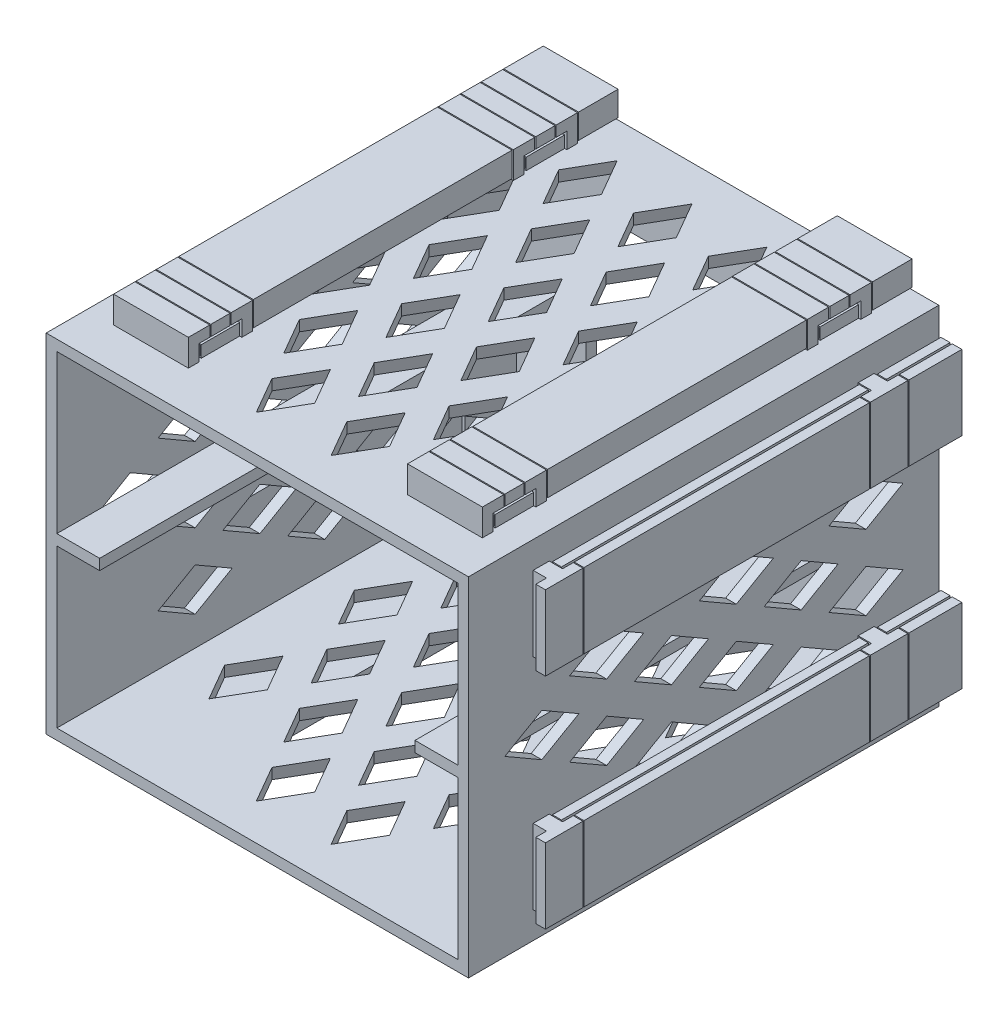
SolidWorks part; units mm, degrees
ref_plane "Alzado" through (0, 0, 0) normal (0, 0, 1) x (1, 0, 0)
ref_plane "Planta" through (0, 0, 0) normal (0, 1, 0) x (1, 0, 0)
ref_plane "Vista lateral" through (0, 0, 0) normal (1, 0, 0) x (0, 0, -1)
sketch "Croquis1" plane through (0, 0, 0) normal (0, 0, -1) x (-1, 0, 0)
  line L1 (-39.5, 32.5) -> (39.5, 32.5)
  line L2 (-39.5, 32.5) -> (-39.5, -32.5)
  line L3 (-39.5, -32.5) -> (39.5, -32.5)
  line L4 (39.5, 32.5) -> (39.5, -32.5)
  line L7 (-24.5, 17.5) -> (24.5, 17.5)
  line L8 (-24.5, 17.5) -> (-24.5, -17.5)
  line L9 (-24.5, -17.5) -> (24.5, -17.5)
  line L10 (24.5, 17.5) -> (24.5, -17.5)
extrude "Fondo" add sketch "Croquis1" against normal blind 2 separate body
sketch "Croquis3" plane through (0, 0, 2) normal (0, 0, 1) x (1, 0, 0)
  line L1 (-39.5, 32.5) -> (39.5, 32.5)
  line L2 (-39.5, 32.5) -> (-39.5, -32.5)
  line L3 (-39.5, -32.5) -> (39.5, -32.5)
  line L4 (39.5, 32.5) -> (39.5, -32.5)
  line L6 (-37.5, 30.5) -> (-37.5, -30.5)
  line L7 (-37.5, 30.5) -> (37.5, 30.5)
  line L8 (37.5, 30.5) -> (37.5, -30.5)
  line L9 (-37.5, -30.5) -> (37.5, -30.5)
extrude "Estructura" add sketch "Croquis3" along normal blind 86
sketch "Croquis5" plane through (-39.5, 0, 0) normal (-1, 0, 0) x (0, 0, 1)
  line L0 (13.628, 25) -> (20.556, 21)
  line L1 (20.556, 21) -> (13.628, 17)
  line L2 (13.628, 17) -> (6.7, 21)
  line L3 (6.7, 21) -> (13.628, 25)
  line L4 (0, -32.5) -> (0, 32.5) construction
  line L5 (88, 32.5) -> (0, 32.5) construction
  line L6 (13.628, 11) -> (20.556, 7)
  line L7 (6.7, 7) -> (13.628, 11)
  line L8 (13.628, 3) -> (6.7, 7)
  line L9 (20.556, 7) -> (13.628, 3)
  line L10 (13.628, -3) -> (20.556, -7)
  line L11 (6.7, -7) -> (13.628, -3)
  line L12 (13.628, -11) -> (6.7, -7)
  line L13 (20.556, -7) -> (13.628, -11)
  line L14 (13.628, -17) -> (20.556, -21)
  line L15 (6.7, -21) -> (13.628, -17)
  line L16 (13.628, -25) -> (6.7, -21)
  line L17 (20.556, -21) -> (13.628, -25)
  line L18 (37.884, 25) -> (44.812, 21)
  line L19 (44.812, 21) -> (37.884, 17)
  line L20 (37.884, 17) -> (30.956, 21)
  line L21 (30.956, 21) -> (37.884, 25)
  line L22 (44.812, 7) -> (37.884, 3)
  line L23 (37.884, 11) -> (44.812, 7)
  line L24 (30.956, 7) -> (37.884, 11)
  line L25 (37.884, 3) -> (30.956, 7)
  line L26 (44.812, -7) -> (37.884, -11)
  line L27 (37.884, -3) -> (44.812, -7)
  line L28 (30.956, -7) -> (37.884, -3)
  line L29 (37.884, -11) -> (30.956, -7)
  line L30 (37.884, -17) -> (44.812, -21)
  line L31 (44.812, -21) -> (37.884, -25)
  line L32 (37.884, -25) -> (30.956, -21)
  line L33 (30.956, -21) -> (37.884, -17)
  line L34 (62.14, 25) -> (69.068, 21)
  line L35 (69.068, 21) -> (62.14, 17)
  line L36 (62.14, 17) -> (55.212, 21)
  line L37 (55.212, 21) -> (62.14, 25)
  line L38 (69.068, 7) -> (62.14, 3)
  line L39 (62.14, 11) -> (69.068, 7)
  line L40 (55.212, 7) -> (62.14, 11)
  line L41 (62.14, 3) -> (55.212, 7)
  line L42 (69.068, -7) -> (62.14, -11)
  line L43 (62.14, -3) -> (69.068, -7)
  line L44 (55.212, -7) -> (62.14, -3)
  line L45 (62.14, -11) -> (55.212, -7)
  line L46 (62.14, -17) -> (69.068, -21)
  line L47 (69.068, -21) -> (62.14, -25)
  line L48 (62.14, -25) -> (55.212, -21)
  line L49 (55.212, -21) -> (62.14, -17)
  line L66 (50.012, 18) -> (56.94, 14)
  line L67 (56.94, 14) -> (50.012, 10)
  line L68 (50.012, 10) -> (43.084, 14)
  line L69 (43.084, 14) -> (50.012, 18)
  line L70 (50.012, 4) -> (56.94, 0)
  line L71 (43.084, 0) -> (50.012, 4)
  line L72 (50.012, -4) -> (43.084, 0)
  line L73 (56.94, -14) -> (50.012, -18)
  line L74 (50.012, -10) -> (56.94, -14)
  line L75 (43.084, -14) -> (50.012, -10)
  line L76 (18.828, 14) -> (25.756, 18)
  line L77 (67.34, 14) -> (74.268, 18) construction
  line L78 (67.34, -14) -> (74.268, -10) construction
  line L79 (74.268, -18) -> (67.34, -14) construction
  line L80 (25.756, 4) -> (32.684, 0)
  line L81 (18.828, 0) -> (25.756, 4)
  line L82 (25.756, -4) -> (18.828, 0)
  line L83 (32.684, 0) -> (25.756, -4)
  line L84 (25.756, -18) -> (18.828, -14)
  line L85 (32.684, -14) -> (25.756, -18)
  line L86 (56.94, 0) -> (50.012, -4)
  line L87 (50.012, -18) -> (43.084, -14)
  line L88 (32.684, 14) -> (25.756, 10)
  line L89 (25.756, 10) -> (18.828, 14)
  line L90 (25.756, 18) -> (32.684, 14)
  line L91 (74.268, 18) -> (81.196, 14) construction
  line L92 (81.196, 14) -> (74.268, 10) construction
  line L93 (74.268, 10) -> (67.34, 14) construction
  line L94 (81.196, 0) -> (74.268, -4)
  line L95 (74.268, 4) -> (81.196, 0)
  line L96 (67.34, 0) -> (74.268, 4)
  line L97 (74.268, -4) -> (67.34, 0)
  line L98 (81.196, -14) -> (74.268, -18) construction
  line L99 (74.268, -10) -> (81.196, -14) construction
  line L100 (25.756, -10) -> (32.684, -14)
  line L101 (18.828, -14) -> (25.756, -10)
  line L102 (88, 32.5) -> (0, 32.5) construction
  line L103 (86.396, 25) -> (93.324, 21)
  line L104 (93.324, 21) -> (86.396, 17)
  line L105 (86.396, 17) -> (79.468, 21)
  line L106 (79.468, 21) -> (86.396, 25)
  line L107 (93.324, 7) -> (86.396, 3)
  line L108 (86.396, 11) -> (93.324, 7)
  line L109 (79.468, 7) -> (86.396, 11)
  line L110 (86.396, 3) -> (79.468, 7)
  line L111 (93.324, -7) -> (86.396, -11)
  line L112 (86.396, -3) -> (93.324, -7)
  line L113 (79.468, -7) -> (86.396, -3)
  line L114 (86.396, -11) -> (79.468, -7)
  line L115 (86.396, -17) -> (93.324, -21)
  line L116 (93.324, -21) -> (86.396, -25)
  line L117 (86.396, -25) -> (79.468, -21)
  line L118 (79.468, -21) -> (86.396, -17)
  dimension "D1" = 7.9998
  dimension "D2" = 7.9998
  dimension "D3" = 6.7
  dimension "D4" = 7.5
  dimension "D5" = 8
  dimension "D7" = 13.856
  dimension "D9" = 24.256
  dimension "D10" = 14.5
  dimension "D11" = 24.256
  dimension "D6" = 4
  dimension "D8" = 4
extrude "RombosHor" cut sketch "Croquis5" against normal up to surface (79 mm away)
sketch "Croquis9" plane through (0, 32.5, 0) normal (0, 1, 0) x (1, 0, 0)
  line L0 (28, -6.6872) -> (24, -13.6154)
  line L1 (28, -6.6872) -> (32, -13.6154)
  line L2 (24, -13.6154) -> (28, -20.5436)
  line L3 (32, -13.6154) -> (28, -20.5436)
  line L4 (14, -6.6872) -> (10, -13.6154)
  line L5 (14, -6.6872) -> (18, -13.6154)
  line L6 (18, -13.6154) -> (14, -20.5436)
  line L7 (10, -13.6154) -> (14, -20.5436)
  line L8 (0, -6.6872) -> (-4, -13.6154)
  line L9 (0, -6.6872) -> (4, -13.6154)
  line L10 (4, -13.6154) -> (0, -20.5436)
  line L11 (-4, -13.6154) -> (0, -20.5436)
  line L12 (-14, -6.6872) -> (-18, -13.6154)
  line L13 (-14, -6.6872) -> (-10, -13.6154)
  line L14 (-10, -13.6154) -> (-14, -20.5436)
  line L15 (-18, -13.6154) -> (-14, -20.5436)
  line L16 (-28, -6.6872) -> (-32, -13.6154)
  line L17 (-28, -6.6872) -> (-24, -13.6154)
  line L18 (-24, -13.6154) -> (-28, -20.5436)
  line L19 (-32, -13.6154) -> (-28, -20.5436)
  line L20 (14, -30.9436) -> (10, -37.8718)
  line L21 (14, -30.9436) -> (18, -37.8718)
  line L22 (18, -37.8718) -> (14, -44.8)
  line L23 (10, -37.8718) -> (14, -44.8)
  line L24 (0, -30.9436) -> (-4, -37.8718)
  line L25 (0, -30.9436) -> (4, -37.8718)
  line L26 (4, -37.8718) -> (0, -44.8)
  line L27 (-4, -37.8718) -> (0, -44.8)
  line L28 (-14, -30.9436) -> (-18, -37.8718)
  line L29 (-14, -30.9436) -> (-10, -37.8718)
  line L30 (-10, -37.8718) -> (-14, -44.8)
  line L31 (-18, -37.8718) -> (-14, -44.8)
  line L32 (-28, -30.9436) -> (-32, -37.8718)
  line L33 (-28, -30.9436) -> (-24, -37.8718)
  line L34 (-24, -37.8718) -> (-28, -44.8)
  line L35 (-32, -37.8718) -> (-28, -44.8)
  line L36 (14, -55.2) -> (10, -62.1282)
  line L37 (14, -55.2) -> (18, -62.1282)
  line L38 (18, -62.1282) -> (14, -69.0564)
  line L39 (10, -62.1282) -> (14, -69.0564)
  line L40 (0, -55.2) -> (-4, -62.1282)
  line L41 (0, -55.2) -> (4, -62.1282)
  line L42 (4, -62.1282) -> (0, -69.0564)
  line L43 (-4, -62.1282) -> (0, -69.0564)
  line L44 (-14, -55.2) -> (-18, -62.1282)
  line L45 (-14, -55.2) -> (-10, -62.1282)
  line L46 (-10, -62.1282) -> (-14, -69.0564)
  line L47 (-18, -62.1282) -> (-14, -69.0564)
  line L48 (-28, -55.2) -> (-32, -62.1282)
  line L49 (-28, -55.2) -> (-24, -62.1282)
  line L50 (-24, -62.1282) -> (-28, -69.0564)
  line L51 (-32, -62.1282) -> (-28, -69.0564)
  line L68 (28, -30.9436) -> (24, -37.8718)
  line L69 (28, -30.9436) -> (32, -37.8718)
  line L70 (32, -37.8718) -> (28, -44.8)
  line L71 (24, -37.8718) -> (28, -44.8)
  line L72 (28, -55.2) -> (24, -62.1282)
  line L73 (28, -55.2) -> (32, -62.1282)
  line L74 (32, -62.1282) -> (28, -69.0564)
  line L75 (24, -62.1282) -> (28, -69.0564)
  line L80 (28, -6.6872) -> (14, -6.6872) construction
  line L81 (28, -6.6872) -> (28, -30.9436) construction
  line L83 (39.5, -88) -> (39.5, 0) construction
  line L87 (-39.5, 0) -> (39.5, 0) construction
  line L88 (17, -50.0018) -> (21, -56.93)
  line L89 (7, -67.33) -> (11, -74.2582)
  line L90 (-7, -67.33) -> (-11, -74.2582)
  line L91 (-7, -67.33) -> (-3, -74.2582)
  line L92 (-3, -74.2582) -> (-7, -81.1864)
  line L93 (-21, -67.33) -> (-25, -74.2582) construction
  line L94 (-21, -67.33) -> (-17, -74.2582) construction
  line L95 (-25, -74.2582) -> (-21, -81.1864) construction
  line L96 (21, -67.33) -> (25, -74.2582) construction
  line L97 (25, -74.2582) -> (21, -81.1864) construction
  line L98 (17, -74.2582) -> (21, -81.1864) construction
  line L99 (7, -18.8172) -> (3, -25.7454)
  line L100 (17, -25.7454) -> (21, -32.6736)
  line L101 (21, -18.8172) -> (25, -25.7454)
  line L102 (-7, -43.0736) -> (-11, -50.0018)
  line L103 (-3, -50.0018) -> (-7, -56.93)
  line L104 (-21, -43.0736) -> (-25, -50.0018)
  line L105 (-21, -43.0736) -> (-17, -50.0018)
  line L106 (-3, -25.7454) -> (-7, -32.6736)
  line L107 (-11, -25.7454) -> (-7, -32.6736)
  line L108 (-21, -18.8172) -> (-17, -25.7454)
  line L109 (-21, -18.8172) -> (-25, -25.7454)
  line L110 (-25, -25.7454) -> (-21, -32.6736)
  line L111 (21, -43.0736) -> (17, -50.0018)
  line L112 (11, -25.7454) -> (7, -32.6736)
  line L113 (7, -18.8172) -> (11, -25.7454)
  line L114 (7, -67.33) -> (3, -74.2582)
  line L115 (11, -74.2582) -> (7, -81.1864)
  line L116 (3, -74.2582) -> (7, -81.1864)
  line L117 (-11, -74.2582) -> (-7, -81.1864)
  line L118 (-17, -74.2582) -> (-21, -81.1864) construction
  line L119 (21, -67.33) -> (17, -74.2582) construction
  line L120 (7, -43.0736) -> (3, -50.0018)
  line L121 (7, -43.0736) -> (11, -50.0018)
  line L122 (11, -50.0018) -> (7, -56.93)
  line L123 (3, -50.0018) -> (7, -56.93)
  line L124 (21, -43.0736) -> (25, -50.0018)
  line L125 (25, -50.0018) -> (21, -56.93)
  line L126 (21, -18.8172) -> (17, -25.7454)
  line L127 (-7, -43.0736) -> (-3, -50.0018)
  line L128 (-11, -50.0018) -> (-7, -56.93)
  line L129 (-17, -50.0018) -> (-21, -56.93)
  line L130 (-25, -50.0018) -> (-21, -56.93)
  line L131 (-7, -18.8172) -> (-11, -25.7454)
  line L132 (-7, -18.8172) -> (-3, -25.7454)
  line L133 (-17, -25.7454) -> (-21, -32.6736)
  line L134 (3, -25.7454) -> (7, -32.6736)
  line L135 (25, -25.7454) -> (21, -32.6736)
  line L136 (18, -86.3846) -> (14, -93.3128)
  line L137 (10, -86.3846) -> (14, -93.3128)
  line L138 (4, -86.3846) -> (0, -93.3128)
  line L139 (-4, -86.3846) -> (0, -93.3128)
  line L140 (-10, -86.3846) -> (-14, -93.3128)
  line L141 (-18, -86.3846) -> (-14, -93.3128)
  line L142 (-24, -86.3846) -> (-28, -93.3128)
  line L143 (-32, -86.3846) -> (-28, -93.3128)
  line L144 (32, -86.3846) -> (28, -93.3128)
  line L145 (24, -86.3846) -> (28, -93.3128)
  line L146 (14, -79.4564) -> (10, -86.3846)
  line L147 (14, -79.4564) -> (18, -86.3846)
  line L148 (0, -79.4564) -> (-4, -86.3846)
  line L149 (0, -79.4564) -> (4, -86.3846)
  line L150 (-14, -79.4564) -> (-18, -86.3846)
  line L151 (-14, -79.4564) -> (-10, -86.3846)
  line L152 (-28, -79.4564) -> (-32, -86.3846)
  line L153 (-28, -79.4564) -> (-24, -86.3846)
  line L154 (28, -79.4564) -> (24, -86.3846)
  line L155 (28, -79.4564) -> (32, -86.3846)
  dimension "D1" = 8
  dimension "D2" = 8
  dimension "D3" = 8
  dimension "D4" = 13.8564
  dimension "D7" = 14
  dimension "D8" = 24.2564
  dimension "D9" = 6.6872
  dimension "D10" = 7.5
  dimension "D5" = 5
  dimension "D6" = 4
extrude "RombosVert" cut sketch "Croquis9" against normal up to surface (65 mm away)
sketch "Croquis8" plane through (0, 0, 2) normal (0, 0, 1) x (1, 0, 0)
  line L0 (-37.5, -30.5) -> (37.5, -30.5) construction
  line L1 (-29.5, -1) -> (-37.5, -1)
  line L2 (-29.5, -1) -> (-29.5, 1)
  line L3 (-29.5, 1) -> (-37.5, 1)
  line L4 (-37.5, -1) -> (-37.5, 1)
  line L5 (29.5, 1) -> (37.5, 1)
  line L6 (29.5, 1) -> (29.5, -1)
  line L7 (29.5, -1) -> (37.5, -1)
  line L8 (37.5, 1) -> (37.5, -1)
  dimension "D1" = 8
  dimension "D2" = 2
  dimension "D3" = 29.5
extrude "Guias" add sketch "Croquis8" along normal blind 86
sketch "Croquis10" plane through (39.5, 0, 0) normal (1, 0, 0) x (0, 0, -1)
  line L0 (-88, 32.5) -> (0, 32.5) construction
  line L1 (-12.104, -27.5) -> (-12.104, -13.5)
  line L2 (-15.104, -13.5) -> (-12.104, -13.5)
  line L3 (-15.104, -27.5) -> (-15.104, -13.5)
  line L4 (-15.104, -27.5) -> (-12.104, -27.5)
  line L5 (-88, 0) -> (0, 0) construction
  line L6 (-75.896, 27.5) -> (-75.896, 13.5)
  line L7 (-72.896, 13.5) -> (-75.896, 13.5)
  line L8 (-72.896, 27.5) -> (-72.896, 13.5)
  line L9 (0, 32.5) -> (0, -32.5) construction
  line L11 (-44, -32.5) -> (-44, 32.5) construction
  line L12 (-15.104, 27.5) -> (-12.104, 27.5)
  line L13 (-15.104, 27.5) -> (-15.104, 13.5)
  line L14 (-15.104, 13.5) -> (-12.104, 13.5)
  line L15 (-12.104, 27.5) -> (-12.104, 13.5)
  line L16 (-72.896, 27.5) -> (-75.896, 27.5)
  line L17 (-72.896, -27.5) -> (-75.896, -27.5)
  line L18 (-72.896, -27.5) -> (-72.896, -13.5)
  line L19 (-72.896, -13.5) -> (-75.896, -13.5)
  line L20 (-75.896, -27.5) -> (-75.896, -13.5)
  line L21 (-88, -32.5) -> (0, -32.5) construction
  dimension "D1" = 44
  dimension "D2" = 32.5
  dimension "D6" = 3
  dimension "D7" = 14
  dimension "D8" = 5
  dimension "D9" = 12.104
extrude "AncDer01" add sketch "Croquis10" along normal blind 2.5
sketch "Croquis11" plane through (42, 0, 0) normal (1, 0, 0) x (0, 0, -1)
  line L0 (-15.104, 13.5) -> (-12.104, 13.5) construction
  line L1 (0, 32.5) -> (0, -32.5) construction
  line L2 (-15.104, 27.5) -> (-15.104, 24.1478) construction
  line L3 (-17.104, 27.5) -> (-10.104, 27.5)
  line L4 (-17.104, 27.5) -> (-17.104, 13.5)
  line L5 (-44, 32.5) -> (-44, -32.5) construction
  line L6 (-12.104, 27.5) -> (-15.104, 27.5) construction
  line L7 (-10.104, -27.5) -> (-10.104, -13.5)
  line L8 (-17.104, 13.5) -> (-10.104, 13.5)
  line L9 (-17.104, -13.5) -> (-10.104, -13.5)
  line L10 (-88, 0) -> (0, 0) construction
  line L11 (-10.104, 27.5) -> (-10.104, 13.5)
  line L12 (-17.104, -27.5) -> (-17.104, -13.5)
  line L13 (-17.104, -27.5) -> (-10.104, -27.5)
  line L14 (-70.896, -27.5) -> (-77.896, -27.5)
  line L15 (-70.896, -27.5) -> (-70.896, -13.5)
  line L16 (-77.896, 27.5) -> (-77.896, 13.5)
  line L17 (-70.896, -13.5) -> (-77.896, -13.5)
  line L18 (-70.896, 13.5) -> (-77.896, 13.5)
  line L19 (-77.896, -27.5) -> (-77.896, -13.5)
  line L20 (-70.896, 27.5) -> (-70.896, 13.5)
  line L21 (-70.896, 27.5) -> (-77.896, 27.5)
  dimension "D1" = 44
  dimension "D2" = 88
  dimension "D3" = 7
  dimension "D4" = 2
extrude "AncDer02" add sketch "Croquis11" along normal blind 1.8
sketch "Croquis12" plane through (0, 32.5, 0) normal (0, 1, 0) x (1, 0, 0)
  line L1 (20.5, -9.604) -> (20.5, -7.604)
  line L2 (34.5, -7.604) -> (20.5, -7.604)
  line L3 (34.5, -9.604) -> (34.5, -7.604)
  line L4 (34.5, -9.604) -> (20.5, -9.604)
  line L5 (20.5, -19.604) -> (20.5, -17.604)
  line L6 (34.5, -17.604) -> (20.5, -17.604)
  line L7 (34.5, -19.604) -> (34.5, -17.604)
  line L8 (34.5, -19.604) -> (20.5, -19.604)
  line L10 (39.5, -44) -> (-39.5, -44) construction
  line L11 (-20.5, -78.396) -> (-20.5, -80.396)
  line L12 (-34.5, -80.396) -> (-20.5, -80.396)
  line L13 (0, -88) -> (0, 0) construction
  line L14 (-34.5, -78.396) -> (-34.5, -80.396)
  line L15 (-34.5, -78.396) -> (-20.5, -78.396)
  line L16 (-20.5, -68.396) -> (-20.5, -70.396)
  line L17 (-34.5, -70.396) -> (-20.5, -70.396)
  line L18 (-34.5, -68.396) -> (-34.5, -70.396)
  line L19 (-34.5, -68.396) -> (-20.5, -68.396)
  line L20 (34.5, -68.396) -> (20.5, -68.396)
  line L21 (-34.5, -19.604) -> (-20.5, -19.604)
  line L22 (-34.5, -19.604) -> (-34.5, -17.604)
  line L23 (-34.5, -17.604) -> (-20.5, -17.604)
  line L24 (-20.5, -19.604) -> (-20.5, -17.604)
  line L25 (-34.5, -9.604) -> (-20.5, -9.604)
  line L26 (-34.5, -9.604) -> (-34.5, -7.604)
  line L27 (-34.5, -7.604) -> (-20.5, -7.604)
  line L28 (-20.5, -9.604) -> (-20.5, -7.604)
  line L29 (34.5, -68.396) -> (34.5, -70.396)
  line L30 (34.5, -70.396) -> (20.5, -70.396)
  line L31 (20.5, -68.396) -> (20.5, -70.396)
  line L32 (34.5, -78.396) -> (20.5, -78.396)
  line L33 (34.5, -78.396) -> (34.5, -80.396)
  line L34 (34.5, -80.396) -> (20.5, -80.396)
  line L35 (20.5, -78.396) -> (20.5, -80.396)
  line L38 (-39.5, 0) -> (39.5, 0) construction
  line L39 (-39.5, -88) -> (-39.5, 0) construction
  dimension "D9" = 88
  dimension "D10" = 44
  dimension "D11" = 2
  dimension "D12" = 2
  dimension "D13" = 14
  dimension "D14" = 14
  dimension "D15" = 5
  dimension "D16" = 5
  dimension "D17" = 7.604
  dimension "D18" = 8
extrude "AncSup01" add sketch "Croquis12" along normal blind 3
sketch "Croquis13" plane through (0, 35.5, 0) normal (0, 1, 0) x (1, 0, 0)
  line L0 (39.5, -44) -> (-39.5, -44) construction
  line L2 (-39.5, 0) -> (39.5, 0) construction
  line L3 (-20.5, -9.604) -> (-20.5, -7.604) construction
  line L4 (-34.5, -7.604) -> (-20.5, -7.604)
  line L5 (-34.5, -7.604) -> (-34.5, -11.604)
  line L6 (-34.5, -11.604) -> (-20.5, -11.604)
  line L7 (-20.5, -7.604) -> (-20.5, -11.604)
  line L8 (-27.4575, -19.604) -> (-21.4543, -19.604) construction
  line L10 (-34.5, -19.604) -> (-20.5, -19.604)
  line L11 (0, 0) -> (0, -88) construction
  line L13 (-34.5, -19.604) -> (-34.5, -15.604)
  line L14 (-34.5, -15.604) -> (-20.5, -15.604)
  line L15 (-20.5, -19.604) -> (-20.5, -15.604)
  line L16 (-20.5, -19.604) -> (-20.5, -17.604) construction
  line L17 (20.5, -19.604) -> (20.5, -15.604)
  line L18 (34.5, -15.604) -> (20.5, -15.604)
  line L19 (34.5, -19.604) -> (34.5, -15.604)
  line L20 (34.5, -19.604) -> (20.5, -19.604)
  line L21 (20.5, -7.604) -> (20.5, -11.604)
  line L22 (34.5, -11.604) -> (20.5, -11.604)
  line L23 (34.5, -7.604) -> (34.5, -11.604)
  line L24 (34.5, -7.604) -> (20.5, -7.604)
  line L25 (34.5, -80.396) -> (20.5, -80.396)
  line L26 (34.5, -80.396) -> (34.5, -76.396)
  line L27 (34.5, -76.396) -> (20.5, -76.396)
  line L28 (20.5, -80.396) -> (20.5, -76.396)
  line L29 (34.5, -68.396) -> (20.5, -68.396)
  line L30 (34.5, -68.396) -> (34.5, -72.396)
  line L31 (34.5, -72.396) -> (20.5, -72.396)
  line L32 (20.5, -68.396) -> (20.5, -72.396)
  line L33 (-20.5, -68.396) -> (-20.5, -72.396)
  line L34 (-34.5, -72.396) -> (-20.5, -72.396)
  line L35 (-34.5, -68.396) -> (-34.5, -72.396)
  line L36 (-34.5, -68.396) -> (-20.5, -68.396)
  line L37 (-20.5, -80.396) -> (-20.5, -76.396)
  line L38 (-34.5, -76.396) -> (-20.5, -76.396)
  line L39 (-34.5, -80.396) -> (-34.5, -76.396)
  line L40 (-34.5, -80.396) -> (-20.5, -80.396)
  dimension "D1" = 44
  dimension "D2" = 88
  dimension "D3" = 4
  dimension "D4" = 4
extrude "AncSup02" add sketch "Croquis13" along normal blind 2
sketch "Croquis52" plane through (-39.5, 0, 0) normal (-1, 0, 0) x (0, 0, 1)
  line L0 (0, -32.5) -> (0, 32.5) construction
  line L1 (88, 32.5) -> (0, 32.5) construction
  line L2 (9.604, -27.5) -> (7.604, -27.5)
  line L3 (9.604, -27.5) -> (9.604, -13.5)
  line L4 (9.604, -13.5) -> (7.604, -13.5)
  line L5 (7.604, -27.5) -> (7.604, -13.5)
  line L6 (19.604, -27.5) -> (17.604, -27.5)
  line L7 (19.604, -27.5) -> (19.604, -13.5)
  line L8 (19.604, -13.5) -> (17.604, -13.5)
  line L9 (44, 32.5) -> (44, -32.5) construction
  line L10 (17.604, -27.5) -> (17.604, -13.5)
  line L11 (78.396, 27.5) -> (80.396, 27.5)
  line L12 (78.396, 27.5) -> (78.396, 13.5)
  line L13 (78.396, 13.5) -> (80.396, 13.5)
  line L14 (80.396, 27.5) -> (80.396, 13.5)
  line L15 (68.396, 27.5) -> (70.396, 27.5)
  line L16 (88, 0) -> (0, 0) construction
  line L17 (68.396, 27.5) -> (68.396, 13.5)
  line L18 (68.396, 13.5) -> (70.396, 13.5)
  line L19 (70.396, 27.5) -> (70.396, 13.5)
  line L20 (70.396, -27.5) -> (70.396, -13.5)
  line L21 (68.396, -13.5) -> (70.396, -13.5)
  line L22 (68.396, -27.5) -> (68.396, -13.5)
  line L23 (68.396, -27.5) -> (70.396, -27.5)
  line L24 (80.396, -27.5) -> (80.396, -13.5)
  line L25 (78.396, -13.5) -> (80.396, -13.5)
  line L26 (78.396, -27.5) -> (78.396, -13.5)
  line L27 (78.396, -27.5) -> (80.396, -27.5)
  line L32 (17.604, 27.5) -> (17.604, 13.5)
  line L33 (19.604, 13.5) -> (17.604, 13.5)
  line L34 (19.604, 27.5) -> (19.604, 13.5)
  line L35 (19.604, 27.5) -> (17.604, 27.5)
  line L36 (7.604, 27.5) -> (7.604, 13.5)
  line L37 (9.604, 13.5) -> (7.604, 13.5)
  line L38 (9.604, 27.5) -> (9.604, 13.5)
  line L39 (9.604, 27.5) -> (7.604, 27.5)
  dimension "D1" = 44
  dimension "D2" = 88
  dimension "D3" = 2
  dimension "D4" = 2
  dimension "D5" = 8
  dimension "D6" = 14
  dimension "D7" = 14
  dimension "D8" = 7.604
  dimension "D9" = 5
  dimension "D10" = 5
extrude "AncIzq01" add sketch "Croquis52" along normal blind 3
sketch "Croquis53" plane through (-42.5, 0, 0) normal (-1, 0, 0) x (0, 0, 1)
  line L0 (44, 32.5) -> (44, -32.5) construction
  line L1 (0, -32.5) -> (0, 32.5) construction
  line L2 (7.604, 13.5) -> (9.604, 13.5) construction
  line L3 (7.604, 27.5) -> (11.604, 27.5)
  line L4 (7.604, 27.5) -> (7.604, 13.5)
  line L5 (7.604, 13.5) -> (11.604, 13.5)
  line L6 (11.604, 27.5) -> (11.604, 13.5)
  line L7 (17.604, 13.5) -> (19.604, 13.5) construction
  line L8 (19.604, 27.5) -> (15.604, 27.5)
  line L10 (19.604, 27.5) -> (19.604, 13.5)
  line L12 (88, 0) -> (0, 0) construction
  line L13 (19.604, 13.5) -> (15.604, 13.5)
  line L14 (15.604, 27.5) -> (15.604, 13.5)
  line L15 (15.604, -27.5) -> (15.604, -13.5)
  line L16 (19.604, -13.5) -> (15.604, -13.5)
  line L17 (19.604, -27.5) -> (19.604, -13.5)
  line L18 (19.604, -27.5) -> (15.604, -27.5)
  line L19 (11.604, -27.5) -> (11.604, -13.5)
  line L20 (7.604, -13.5) -> (11.604, -13.5)
  line L21 (7.604, -27.5) -> (7.604, -13.5)
  line L22 (7.604, -27.5) -> (11.604, -27.5)
  line L23 (80.396, -27.5) -> (76.396, -27.5)
  line L24 (80.396, -27.5) -> (80.396, -13.5)
  line L25 (80.396, -13.5) -> (76.396, -13.5)
  line L26 (76.396, -27.5) -> (76.396, -13.5)
  line L27 (68.396, -27.5) -> (72.396, -27.5)
  line L28 (68.396, -27.5) -> (68.396, -13.5)
  line L29 (68.396, -13.5) -> (72.396, -13.5)
  line L30 (72.396, -27.5) -> (72.396, -13.5)
  line L31 (72.396, 27.5) -> (72.396, 13.5)
  line L32 (68.396, 13.5) -> (72.396, 13.5)
  line L33 (68.396, 27.5) -> (68.396, 13.5)
  line L34 (68.396, 27.5) -> (72.396, 27.5)
  line L35 (76.396, 27.5) -> (76.396, 13.5)
  line L36 (80.396, 13.5) -> (76.396, 13.5)
  line L37 (80.396, 27.5) -> (80.396, 13.5)
  line L38 (80.396, 27.5) -> (76.396, 27.5)
  dimension "D1" = 44
  dimension "D2" = 88
  dimension "D3" = 4
  dimension "D4" = 4
extrude "AncIzq02" add sketch "Croquis53" along normal blind 2
sketch "Croquis54" plane through (0, -32.5, 0) normal (0, -1, 0) x (1, 0, 0)
  line L0 (0, 88) -> (0, 0) construction
  line L1 (-34.5, 15.104) -> (-20.5, 15.104)
  line L2 (-34.5, 15.104) -> (-34.5, 12.104)
  line L3 (-34.5, 12.104) -> (-20.5, 12.104)
  line L4 (-20.5, 15.104) -> (-20.5, 12.104)
  line L5 (-39.5, 88) -> (39.5, 88) construction
  line L6 (-39.5, 44) -> (39.5, 44) construction
  line L7 (-39.5, 88) -> (-39.5, 0) construction
  line L8 (39.5, 88) -> (39.5, 0) construction
  line L9 (39.5, 0) -> (-39.5, 0) construction
  line L10 (20.5, 15.104) -> (20.5, 12.104)
  line L11 (34.5, 12.104) -> (20.5, 12.104)
  line L12 (34.5, 15.104) -> (34.5, 12.104)
  line L13 (34.5, 15.104) -> (20.5, 15.104)
  line L14 (34.5, 72.896) -> (20.5, 72.896)
  line L15 (34.5, 72.896) -> (34.5, 75.896)
  line L16 (34.5, 75.896) -> (20.5, 75.896)
  line L17 (20.5, 72.896) -> (20.5, 75.896)
  line L18 (-20.5, 72.896) -> (-20.5, 75.896)
  line L19 (-34.5, 75.896) -> (-20.5, 75.896)
  line L20 (-34.5, 72.896) -> (-34.5, 75.896)
  line L21 (-34.5, 72.896) -> (-20.5, 72.896)
  dimension "D1" = 3
  dimension "D2" = 14
  dimension "D3" = 5
  dimension "D4" = 12.104
extrude "AncInf01" add sketch "Croquis54" along normal blind 2.5
sketch "Croquis55" plane through (0, -35, 0) normal (0, -1, 0) x (1, 0, 0)
  line L1 (-34.5, 77.896) -> (-20.5, 77.896)
  line L2 (-34.5, 77.896) -> (-34.5, 70.896)
  line L3 (-34.5, 70.896) -> (-20.5, 70.896)
  line L4 (-20.5, 77.896) -> (-20.5, 70.896)
  line L6 (-20.5, 72.896) -> (-20.5, 75.896) construction
  line L7 (-34.5, 75.896) -> (-34.5, 72.896) construction
  line L8 (-34.5, 72.896) -> (-20.5, 72.896) construction
  line L9 (-39.5, 44) -> (39.5, 44) construction
  line L10 (-39.5, 88) -> (-39.5, 0) construction
  line L11 (39.5, 88) -> (39.5, 0) construction
  line L12 (0, 88) -> (0, 0) construction
  line L13 (-39.5, 88) -> (39.5, 88) construction
  line L14 (20.5, 77.896) -> (20.5, 70.896)
  line L15 (34.5, 70.896) -> (20.5, 70.896)
  line L16 (34.5, 77.896) -> (34.5, 70.896)
  line L17 (34.5, 77.896) -> (20.5, 77.896)
  line L18 (34.5, 10.104) -> (20.5, 10.104)
  line L19 (34.5, 10.104) -> (34.5, 17.104)
  line L20 (34.5, 17.104) -> (20.5, 17.104)
  line L21 (20.5, 10.104) -> (20.5, 17.104)
  line L22 (-20.5, 10.104) -> (-20.5, 17.104)
  line L23 (-34.5, 17.104) -> (-20.5, 17.104)
  line L24 (-34.5, 10.104) -> (-34.5, 17.104)
  line L25 (-34.5, 10.104) -> (-20.5, 10.104)
  dimension "D1" = 7
  dimension "D2" = 2
extrude "AncInf02" add sketch "Croquis55" along normal blind 1.8
sketch "Croquis61" plane through (0, 0, 0) normal (0, 0, -1) x (-1, 0, 0)
  line L1 (20.5, 32.9) -> (34.5, 32.9)
  line L2 (20.5, 32.9) -> (20.5, 37.5)
  line L3 (20.5, 37.5) -> (34.5, 37.5)
  line L4 (34.5, 32.9) -> (34.5, 37.5)
  line L5 (20.7, 33.1) -> (20.7, 37.3)
  line L6 (20.7, 37.3) -> (34.3, 37.3)
  line L7 (34.3, 33.1) -> (34.3, 37.3)
  line L8 (20.7, 33.1) -> (34.3, 33.1)
  line L9 (0, 32.5) -> (0, 17.5) construction
  line L10 (39.5, 32.5) -> (-39.5, 32.5) construction
  line L11 (24.5, 17.5) -> (-24.5, 17.5) construction
  line L12 (-20.7, 33.1) -> (-34.3, 33.1)
  line L13 (-34.3, 33.1) -> (-34.3, 37.3)
  line L14 (-20.7, 37.3) -> (-34.3, 37.3)
  line L15 (-20.7, 33.1) -> (-20.7, 37.3)
  line L16 (-34.5, 32.9) -> (-34.5, 37.5)
  line L17 (-20.5, 37.5) -> (-34.5, 37.5)
  line L18 (-20.5, 32.9) -> (-20.5, 37.5)
  line L19 (-20.5, 32.9) -> (-34.5, 32.9)
  dimension "D1" = 0.2
extrude "EspAncSup01" add sketch "Croquis61" against normal blind 7.404 separate body
ref_plane "PlanoEspAncSup01" through (0, 0, 19.804) normal (0, 0, 1) x (1, 0, 0)
sketch "Croquis57" plane through (0, 0, 19.804) normal (0, 0, 1) x (1, 0, 0)
  line L1 (34.5, 37.5) -> (20.5457, 37.5)
  line L2 (34.5, 37.5) -> (34.5, 32.9)
  line L3 (34.5, 32.9) -> (20.5457, 32.9)
  line L4 (20.5457, 37.5) -> (20.5457, 32.9)
  line L5 (34.3, 37.3) -> (34.3, 33.1)
  line L6 (34.3, 33.1) -> (20.7457, 33.1)
  line L7 (20.7457, 37.3) -> (20.7457, 33.1)
  line L8 (34.3, 37.3) -> (20.7457, 37.3)
  line L9 (0, 32.5) -> (0, 17.5) construction
  line L10 (-24.5, 17.5) -> (24.5, 17.5) construction
  line L11 (-34.3, 37.3) -> (-20.7457, 37.3)
  line L12 (-20.7457, 37.3) -> (-20.7457, 33.1)
  line L13 (-34.3, 33.1) -> (-20.7457, 33.1)
  line L14 (-34.3, 37.3) -> (-34.3, 33.1)
  line L15 (-20.5457, 37.5) -> (-20.5457, 32.9)
  line L16 (-34.5, 32.9) -> (-20.5457, 32.9)
  line L17 (-34.5, 37.5) -> (-34.5, 32.9)
  line L18 (-34.5, 37.5) -> (-20.5457, 37.5)
  dimension "D1" = 0.2
sketch "Croquis58" plane through (0, 0, 19.804) normal (0, 0, 1) x (1, 0, 0)
  line L0 (33.8, 36.8) -> (33.8, 33.6)
  line L1 (0, 32.5) -> (0, 17.5) construction
  line L2 (-33.6, 36.6) -> (-21.4457, 36.6)
  line L3 (-21.4457, 36.6) -> (-21.4457, 33.8)
  line L4 (-33.6, 33.8) -> (-21.4457, 33.8)
  line L5 (33.8, 33.6) -> (21.2457, 33.6)
  line L6 (21.2457, 36.8) -> (21.2457, 33.6)
  line L7 (33.8, 36.8) -> (21.2457, 36.8)
  line L8 (33.6, 36.6) -> (33.6, 33.8)
  line L9 (33.6, 33.8) -> (21.4457, 33.8)
  line L10 (21.4457, 36.6) -> (21.4457, 33.8)
  line L11 (33.6, 36.6) -> (21.4457, 36.6)
  line L12 (-33.6, 36.6) -> (-33.6, 33.8)
  line L13 (-33.8, 36.8) -> (-21.2457, 36.8)
  line L14 (-21.2457, 36.8) -> (-21.2457, 33.6)
  line L15 (-33.8, 33.6) -> (-21.2457, 33.6)
  line L16 (-33.8, 36.8) -> (-33.8, 33.6)
  dimension "D2" = 0.2
sketch "Croquis59" plane through (0, 0, 19.804) normal (0, 0, 1) x (1, 0, 0)
  line L0 (33.1, 36.1) -> (33.1, 34.3)
  line L1 (0, 32.5) -> (0, 17.5) construction
  line L2 (-32.9, 35.9) -> (-22.1457, 35.9)
  line L3 (-22.1457, 35.9) -> (-22.1457, 34.5)
  line L4 (-32.9, 34.5) -> (-22.1457, 34.5)
  line L5 (33.1, 34.3) -> (21.9457, 34.3)
  line L6 (21.9457, 36.1) -> (21.9457, 34.3)
  line L7 (33.1, 36.1) -> (21.9457, 36.1)
  line L8 (32.9, 35.9) -> (32.9, 34.5)
  line L9 (32.9, 34.5) -> (22.1457, 34.5)
  line L10 (22.1457, 35.9) -> (22.1457, 34.5)
  line L11 (32.9, 35.9) -> (22.1457, 35.9)
  line L12 (-32.9, 35.9) -> (-32.9, 34.5)
  line L13 (-33.1, 36.1) -> (-21.9457, 36.1)
  line L14 (-21.9457, 36.1) -> (-21.9457, 34.3)
  line L15 (-33.1, 34.3) -> (-21.9457, 34.3)
  line L16 (-33.1, 36.1) -> (-33.1, 34.3)
  dimension "D2" = 0.2
extrude "EspAncSup02" add sketch "Croquis57" along normal blind 48.392
extrude "EspAncSup03" add sketch "Croquis58" along normal blind 48.392 separate body
extrude "EspAncSup04" add sketch "Croquis59" along normal blind 48.392 separate body
ref_plane "PlanoEspAncSup02" through (0, 32.9, 0) normal (0, 1, 0) x (1, 0, 0)
sketch "Croquis64" plane through (0, 32.9, 0) normal (0, 1, 0) x (1, 0, 0)
  line L0 (-34.5, -9.604) -> (-29.684, -9.604) construction
  line L1 (-20.5, -17.204) -> (-34.5, -17.204)
  line L2 (-20.5, -17.204) -> (-20.5, -10.004)
  line L3 (-20.5, -10.004) -> (-34.5, -10.004)
  line L4 (-34.5, -17.204) -> (-34.5, -10.004)
  line L5 (-29.6972, -17.604) -> (-34.5, -17.604) construction
  line L6 (-34.5, -7.604) -> (-34.5, -9.604) construction
  line L7 (-39.5, -44) -> (39.5, -44) construction
  line L8 (-39.5, -88) -> (-39.5, 0) construction
  line L9 (39.5, -88) -> (39.5, 0) construction
  line L10 (0, 0) -> (0, -88) construction
  line L11 (39.5, -88) -> (-39.5, -88) construction
  line L12 (34.5, -17.204) -> (34.5, -10.004)
  line L13 (20.5, -10.004) -> (34.5, -10.004)
  line L14 (20.5, -17.204) -> (20.5, -10.004)
  line L15 (20.5, -17.204) -> (34.5, -17.204)
  line L16 (20.5, -70.796) -> (34.5, -70.796)
  line L17 (20.5, -70.796) -> (20.5, -77.996)
  line L18 (20.5, -77.996) -> (34.5, -77.996)
  line L19 (34.5, -70.796) -> (34.5, -77.996)
  line L20 (-34.5, -70.796) -> (-34.5, -77.996)
  line L21 (-20.5, -77.996) -> (-34.5, -77.996)
  line L22 (-20.5, -70.796) -> (-20.5, -77.996)
  line L23 (-20.5, -70.796) -> (-34.5, -70.796)
  dimension "D1" = 0.4
  dimension "D2" = 0.4
  dimension "D3" = 14
extrude "EspAncSup05" add sketch "Croquis64" along normal blind 2.2
sketch "Croquis66" plane through (0, 0, 17.204) normal (0, 0, 1) x (1, 0, 0)
  line L0 (-34.3, 34.9) -> (-34.3, 33.1)
  line L1 (0, 17.5) -> (0, 30.5) construction
  line L2 (-24.5, 17.5) -> (24.5, 17.5) construction
  line L3 (37.5, 30.5) -> (-37.5, 30.5) construction
  line L4 (34.3, 34.9) -> (20.7, 34.9)
  line L5 (-34.3, 33.1) -> (-20.7, 33.1)
  line L6 (-20.7, 34.9) -> (-20.7, 33.1)
  line L7 (-34.3, 34.9) -> (-20.7, 34.9)
  line L8 (20.7, 34.9) -> (20.7, 33.1)
  line L9 (34.3, 33.1) -> (20.7, 33.1)
  line L10 (34.3, 34.9) -> (34.3, 33.1)
extrude "EspAncSup06" cut sketch "Croquis66" against normal up to next (7.2 mm away)
sketch "Croquis68" plane through (0, 0, 77.996) normal (0, 0, 1) x (1, 0, 0)
  line L0 (34.3, 34.9) -> (34.3, 33.1)
  line L1 (0, 17.5) -> (0, 32.5) construction
  line L2 (-24.5, 17.5) -> (24.5, 17.5) construction
  line L3 (-34.3, 34.9) -> (-20.7, 34.9)
  line L4 (-20.7, 34.9) -> (-20.7, 33.1)
  line L5 (34.3, 33.1) -> (20.7, 33.1)
  line L6 (20.7, 34.9) -> (20.7, 33.1)
  line L7 (34.3, 34.9) -> (20.7, 34.9)
  line L8 (-34.3, 33.1) -> (-20.7, 33.1)
  line L9 (-34.3, 34.9) -> (-34.3, 33.1)
extrude "EspAncSup07" cut sketch "Croquis68" against normal up to next (7.2 mm away)
sketch "Croquis70" plane through (0, 35.5, 0) normal (0, -1, 0) x (1, 0, 0)
  line L1 (20.5, 70.396) -> (20.5, 72.396) construction
  line L2 (20.5, 72.396) -> (34.5, 72.396) construction
  line L3 (34.5, 76.396) -> (20.5, 76.396) construction
  line L4 (34.5, 72.396) -> (34.5, 70.396) construction
  line L5 (-34.5, 76.196) -> (-34.5, 72.596)
  line L6 (-20.5, 72.596) -> (-34.5, 72.596)
  line L7 (-20.5, 76.196) -> (-20.5, 72.596)
  line L8 (0, 88) -> (0, 0) construction
  line L9 (39.5, 88) -> (-39.5, 88) construction
  line L10 (39.5, 44) -> (-39.5, 44) construction
  line L11 (39.5, 88) -> (39.5, 0) construction
  line L12 (-39.5, 88) -> (-39.5, 0) construction
  line L13 (-20.5, 76.196) -> (-34.5, 76.196)
  line L14 (34.5, 11.804) -> (34.5, 15.404)
  line L15 (20.5, 15.404) -> (34.5, 15.404)
  line L16 (20.5, 11.804) -> (20.5, 15.404)
  line L17 (20.5, 76.196) -> (34.5, 76.196)
  line L18 (20.5, 76.196) -> (20.5, 72.596)
  line L19 (20.5, 72.596) -> (34.5, 72.596)
  line L20 (34.5, 76.196) -> (34.5, 72.596)
  line L21 (20.5, 11.804) -> (34.5, 11.804)
  line L22 (-20.5, 11.804) -> (-34.5, 11.804)
  line L23 (-20.5, 11.804) -> (-20.5, 15.404)
  line L24 (-20.5, 15.404) -> (-34.5, 15.404)
  line L25 (-34.5, 11.804) -> (-34.5, 15.404)
  dimension "D1" = 0.2
  dimension "D2" = 0.2
extrude "EspAncSup08" add sketch "Croquis70" against normal blind 2 separate body
sketch "Croquis71" plane through (0, 0, 72.596) normal (0, 0, -1) x (-1, 0, 0)
  line L0 (-34.3, 37.3) -> (-34.3, 35.7)
  line L2 (0, 32.5) -> (0, 17.5) construction
  line L3 (39.5, 32.5) -> (-39.5, 32.5) construction
  line L4 (24.5, 17.5) -> (-24.5, 17.5) construction
  line L5 (-20.7, 35.7) -> (-34.3, 35.7)
  line L6 (-20.7, 37.3) -> (-20.7, 35.7)
  line L7 (-20.7, 37.3) -> (-34.3, 37.3)
  line L8 (20.7, 37.3) -> (34.3, 37.3)
  line L9 (20.7, 37.3) -> (20.7, 35.7)
  line L10 (20.7, 35.7) -> (34.3, 35.7)
  line L11 (34.3, 37.3) -> (34.3, 35.7)
extrude "EspAncSup09" cut sketch "Croquis71" against normal up to next (3.6 mm away)
sketch "Croquis72" plane through (0, 0, 11.804) normal (0, 0, -1) x (-1, 0, 0)
  line L0 (-34.3, 37.3) -> (-34.3, 35.7)
  line L1 (0, 32.5) -> (0, 17.5) construction
  line L2 (39.5, 32.5) -> (-39.5, 32.5) construction
  line L3 (24.5, 17.5) -> (-24.5, 17.5) construction
  line L4 (34.3, 37.3) -> (20.7, 37.3)
  line L5 (-34.3, 35.7) -> (-20.7, 35.7)
  line L6 (-20.7, 37.3) -> (-20.7, 35.7)
  line L7 (-34.3, 37.3) -> (-20.7, 37.3)
  line L8 (20.7, 37.3) -> (20.7, 35.7)
  line L9 (34.3, 35.7) -> (20.7, 35.7)
  line L10 (34.3, 37.3) -> (34.3, 35.7)
extrude "EspAncSup10" cut sketch "Croquis72" against normal up to next (3.6 mm away)
sketch "Croquis73" plane through (0, 0, 0) normal (0, 0, -1) x (-1, 0, 0)
  line L1 (39.9, 27.5) -> (44.5, 27.5)
  line L2 (39.9, 27.5) -> (39.9, 13.5)
  line L3 (39.9, 13.5) -> (44.5, 13.5)
  line L4 (44.5, 27.5) -> (44.5, 13.5)
  line L6 (39.5, 0) -> (24.5, 0) construction
  line L7 (39.5, -32.5) -> (39.5, 32.5) construction
  line L8 (24.5, -17.5) -> (24.5, 17.5) construction
  line L9 (40.1, -27.3) -> (40.1, -13.7)
  line L10 (40.1, -13.7) -> (44.3, -13.7)
  line L11 (44.3, -27.3) -> (44.3, -13.7)
  line L12 (40.1, -27.3) -> (44.3, -27.3)
  line L13 (40.1, 27.3) -> (44.3, 27.3)
  line L14 (44.3, 27.3) -> (44.3, 13.7)
  line L15 (40.1, 13.7) -> (44.3, 13.7)
  line L16 (40.1, 27.3) -> (40.1, 13.7)
  line L17 (44.5, -27.5) -> (44.5, -13.5)
  line L18 (39.9, -13.5) -> (44.5, -13.5)
  line L19 (39.9, -27.5) -> (39.9, -13.5)
  line L20 (39.9, -27.5) -> (44.5, -27.5)
  dimension "D1" = 0.2
extrude "EspAncIzq01" add sketch "Croquis73" against normal blind 7.404 separate body
sketch "Croquis74" plane through (0, 0, 19.804) normal (0, 0, 1) x (1, 0, 0)
  line L1 (-39.9, 27.5) -> (-44.5, 27.5)
  line L2 (-39.9, 27.5) -> (-39.9, 13.5)
  line L3 (-39.9, 13.5) -> (-44.5, 13.5)
  line L4 (-44.5, 27.5) -> (-44.5, 13.5)
  line L5 (-40.1, 27.3) -> (-44.3, 27.3)
  line L6 (-44.3, 27.3) -> (-44.3, 13.7)
  line L7 (-40.1, 13.7) -> (-44.3, 13.7)
  line L8 (-40.1, 27.3) -> (-40.1, 13.7)
  line L9 (-39.5, 0) -> (-24.5, 0) construction
  line L10 (-39.5, 32.5) -> (-39.5, -32.5) construction
  line L11 (-24.5, -17.5) -> (-24.5, 17.5) construction
  line L12 (-40.1, -27.3) -> (-40.1, -13.7)
  line L13 (-40.1, -13.7) -> (-44.3, -13.7)
  line L14 (-44.3, -27.3) -> (-44.3, -13.7)
  line L15 (-40.1, -27.3) -> (-44.3, -27.3)
  line L16 (-44.5, -27.5) -> (-44.5, -13.5)
  line L17 (-39.9, -13.5) -> (-44.5, -13.5)
  line L18 (-39.9, -27.5) -> (-39.9, -13.5)
  line L19 (-39.9, -27.5) -> (-44.5, -27.5)
  dimension "D1" = 0.2
sketch "Croquis75" plane through (0, 0, 19.804) normal (0, 0, 1) x (1, 0, 0)
  line L0 (-40.6, 26.8) -> (-40.6, 14.2)
  line L1 (-39.5, 0) -> (-24.5, 0) construction
  line L2 (-40.8, -26.6) -> (-40.8, -14.4)
  line L3 (-40.8, -14.4) -> (-43.6, -14.4)
  line L4 (-43.6, -26.6) -> (-43.6, -14.4)
  line L5 (-40.6, 14.2) -> (-43.8, 14.2)
  line L6 (-43.8, 26.8) -> (-43.8, 14.2)
  line L7 (-40.6, 26.8) -> (-43.8, 26.8)
  line L8 (-40.8, 26.6) -> (-43.6, 26.6)
  line L9 (-43.6, 26.6) -> (-43.6, 14.4)
  line L10 (-40.8, 14.4) -> (-43.6, 14.4)
  line L11 (-40.8, 26.6) -> (-40.8, 14.4)
  line L12 (-40.8, -26.6) -> (-43.6, -26.6)
  line L13 (-40.6, -26.8) -> (-43.8, -26.8)
  line L14 (-43.8, -26.8) -> (-43.8, -14.2)
  line L15 (-40.6, -14.2) -> (-43.8, -14.2)
  line L16 (-40.6, -26.8) -> (-40.6, -14.2)
  dimension "D2" = 0.2
sketch "Croquis76" plane through (0, 0, 19.804) normal (0, 0, 1) x (1, 0, 0)
  line L0 (-41.3, 26.1) -> (-41.3, 14.9)
  line L1 (-39.5, 0) -> (-24.5, 0) construction
  line L2 (-41.5, -25.9) -> (-42.9, -25.9)
  line L3 (-42.9, -25.9) -> (-42.9, -15.1)
  line L4 (-41.5, -15.1) -> (-42.9, -15.1)
  line L5 (-41.3, 14.9) -> (-43.1, 14.9)
  line L6 (-43.1, 26.1) -> (-43.1, 14.9)
  line L7 (-41.3, 26.1) -> (-43.1, 26.1)
  line L8 (-41.5, 25.9) -> (-41.5, 15.1)
  line L9 (-41.5, 15.1) -> (-42.9, 15.1)
  line L10 (-42.9, 25.9) -> (-42.9, 15.1)
  line L11 (-41.5, 25.9) -> (-42.9, 25.9)
  line L12 (-41.5, -25.9) -> (-41.5, -15.1)
  line L13 (-41.3, -26.1) -> (-43.1, -26.1)
  line L14 (-43.1, -26.1) -> (-43.1, -14.9)
  line L15 (-41.3, -14.9) -> (-43.1, -14.9)
  line L16 (-41.3, -26.1) -> (-41.3, -14.9)
  dimension "D2" = 0.2
extrude "EspAncIzq02" add sketch "Croquis74" along normal blind 48.392 separate body
extrude "EspAncIzq03" add sketch "Croquis75" along normal blind 48.392 separate body
extrude "EspAncIzq04" add sketch "Croquis76" along normal blind 48.392 separate body
ref_plane "PlanoEspAncIzq01" through (-39.9, 0, 0) normal (-1, 0, 0) x (0, 0, 1)
sketch "Croquis77" plane through (-39.9, 0, 0) normal (-1, 0, 0) x (0, 0, 1)
  line L1 (9.804, 13.5) -> (17.404, 13.5)
  line L2 (9.804, 13.5) -> (9.804, 27.5)
  line L3 (9.804, 27.5) -> (17.404, 27.5)
  line L4 (17.404, 13.5) -> (17.404, 27.5)
  line L5 (19.604, 27.5) -> (17.604, 27.5) construction
  line L7 (7.604, 13.5) -> (9.604, 13.5) construction
  line L8 (44, 32.5) -> (44, -32.5) construction
  line L9 (88, 32.5) -> (0, 32.5) construction
  line L10 (88, -32.5) -> (0, -32.5) construction
  line L11 (88, 0) -> (0, 0) construction
  line L12 (88, 32.5) -> (88, -32.5) construction
  line L13 (0, -32.5) -> (0, 32.5) construction
  line L14 (70.596, 13.5) -> (70.596, 27.5)
  line L15 (78.196, 27.5) -> (70.596, 27.5)
  line L16 (78.196, 13.5) -> (78.196, 27.5)
  line L17 (78.196, 13.5) -> (70.596, 13.5)
  line L18 (78.196, -13.5) -> (70.596, -13.5)
  line L19 (78.196, -13.5) -> (78.196, -27.5)
  line L20 (78.196, -27.5) -> (70.596, -27.5)
  line L21 (70.596, -13.5) -> (70.596, -27.5)
  line L22 (17.404, -13.5) -> (17.404, -27.5)
  line L23 (9.804, -27.5) -> (17.404, -27.5)
  line L24 (9.804, -13.5) -> (9.804, -27.5)
  line L25 (9.804, -13.5) -> (17.404, -13.5)
extrude "EspAncIzq05" add sketch "Croquis77" along normal blind 2.2
sketch "Croquis78" plane through (0, 0, 9.804) normal (0, 0, -1) x (-1, 0, 0)
  line L0 (41.9, 13.7) -> (41.9, 27.3)
  line L1 (39.5, 0) -> (24.5, 0) construction
  line L2 (24.5, -17.5) -> (24.5, 17.5) construction
  line L3 (41.9, -13.7) -> (40.1, -13.7)
  line L4 (40.1, -13.7) -> (40.1, -27.3)
  line L5 (41.9, 27.3) -> (40.1, 27.3)
  line L6 (40.1, 13.7) -> (40.1, 27.3)
  line L7 (41.9, 13.7) -> (40.1, 13.7)
  line L8 (41.9, -27.3) -> (40.1, -27.3)
  line L9 (41.9, -13.7) -> (41.9, -27.3)
extrude "EspAncIzq06" cut sketch "Croquis78" against normal up to next
sketch "Croquis79" plane through (0, 0, 70.596) normal (0, 0, -1) x (-1, 0, 0)
  line L0 (40.1, 27.3) -> (40.1, 13.7)
  line L1 (39.5, 0) -> (24.5, 0) construction
  line L2 (39.5, -32.5) -> (39.5, 32.5) construction
  line L3 (24.5, -17.5) -> (24.5, 17.5) construction
  line L4 (40.1, -27.3) -> (41.9, -27.3)
  line L5 (40.1, 13.7) -> (41.9, 13.7)
  line L6 (41.9, 27.3) -> (41.9, 13.7)
  line L7 (40.1, 27.3) -> (41.9, 27.3)
  line L8 (41.9, -27.3) -> (41.9, -13.7)
  line L9 (40.1, -13.7) -> (41.9, -13.7)
  line L10 (40.1, -27.3) -> (40.1, -13.7)
extrude "EspAncIzq07" cut sketch "Croquis79" against normal up to next
sketch "Croquis80" plane through (-42.5, 0, 0) normal (1, 0, 0) x (0, 0, -1)
  line L1 (-15.404, -13.5) -> (-11.804, -13.5)
  line L2 (-15.404, -13.5) -> (-15.404, -27.5)
  line L3 (-15.404, -27.5) -> (-11.804, -27.5)
  line L4 (-11.804, -13.5) -> (-11.804, -27.5)
  line L5 (-11.604, -27.5) -> (-11.604, -13.5) construction
  line L6 (-9.604, -27.5) -> (-11.604, -27.5) construction
  line L8 (-17.604, -13.5) -> (-15.604, -13.5) construction
  line L9 (-15.604, -13.5) -> (-15.604, -27.5) construction
  line L10 (-44, -32.5) -> (-44, 32.5) construction
  line L11 (-88, -32.5) -> (0, -32.5) construction
  line L12 (-88, 32.5) -> (0, 32.5) construction
  line L13 (0, 0) -> (-88, 0) construction
  line L14 (-88, 32.5) -> (-88, -32.5) construction
  line L15 (-76.196, -13.5) -> (-76.196, -27.5)
  line L16 (-72.596, -27.5) -> (-76.196, -27.5)
  line L17 (-72.596, -13.5) -> (-72.596, -27.5)
  line L18 (-72.596, -13.5) -> (-76.196, -13.5)
  line L19 (-72.596, 13.5) -> (-76.196, 13.5)
  line L20 (-72.596, 13.5) -> (-72.596, 27.5)
  line L21 (-72.596, 27.5) -> (-76.196, 27.5)
  line L22 (-76.196, 13.5) -> (-76.196, 27.5)
  line L23 (-11.804, 13.5) -> (-11.804, 27.5)
  line L24 (-15.404, 27.5) -> (-11.804, 27.5)
  line L25 (-15.404, 13.5) -> (-15.404, 27.5)
  line L26 (-15.404, 13.5) -> (-11.804, 13.5)
  dimension "D1" = 0.2
  dimension "D2" = 0.2
extrude "EspAncIzq08" add sketch "Croquis80" against normal blind 2
sketch "Croquis81" plane through (0, 0, 11.804) normal (0, 0, -1) x (-1, 0, 0)
  line L0 (44.3, -27.3) -> (44.3, -13.7)
  line L1 (39.5, 0) -> (24.5, 0) construction
  line L2 (39.5, -32.5) -> (39.5, 32.5) construction
  line L3 (24.5, -17.5) -> (24.5, 17.5) construction
  line L4 (44.3, 27.3) -> (42.7, 27.3)
  line L5 (44.3, -13.7) -> (42.7, -13.7)
  line L6 (42.7, -27.3) -> (42.7, -13.7)
  line L7 (44.3, -27.3) -> (42.7, -27.3)
  line L8 (42.7, 27.3) -> (42.7, 13.7)
  line L9 (44.3, 13.7) -> (42.7, 13.7)
  line L10 (44.3, 27.3) -> (44.3, 13.7)
extrude "EspAncIzq09" cut sketch "Croquis81" against normal up to next
sketch "Croquis82" plane through (0, 0, 72.596) normal (0, 0, -1) x (-1, 0, 0)
  line L0 (44.3, 27.3) -> (44.3, 13.7)
  line L1 (39.5, 0) -> (24.5, 0) construction
  line L2 (39.5, -32.5) -> (39.5, 32.5) construction
  line L3 (24.5, -17.5) -> (24.5, 17.5) construction
  line L4 (44.3, -27.3) -> (42.7, -27.3)
  line L5 (44.3, 13.7) -> (42.7, 13.7)
  line L6 (42.7, 27.3) -> (42.7, 13.7)
  line L7 (44.3, 27.3) -> (42.7, 27.3)
  line L8 (42.7, -27.3) -> (42.7, -13.7)
  line L9 (44.3, -13.7) -> (42.7, -13.7)
  line L10 (44.3, -27.3) -> (44.3, -13.7)
extrude "EspAncIzq10" cut sketch "Croquis82" against normal up to next
sketch "Croquis83" plane through (0, 0, 0) normal (0, 0, -1) x (-1, 0, 0)
  line L1 (34.5, -32.9) -> (20.5, -32.9)
  line L2 (34.5, -32.9) -> (34.5, -34.6)
  line L3 (34.5, -34.6) -> (20.5, -34.6)
  line L4 (20.5, -32.9) -> (20.5, -34.6)
  line L8 (-39.5, -32.5) -> (39.5, -32.5) construction
  line L9 (34.3, -33.1) -> (20.7, -33.1)
  line L10 (20.7, -33.1) -> (20.7, -34.4)
  line L11 (34.3, -34.4) -> (20.7, -34.4)
  line L12 (34.3, -33.1) -> (34.3, -34.4)
  line L13 (0, -32.5) -> (0, -17.5) construction
  line L14 (-24.5, -17.5) -> (24.5, -17.5) construction
  line L15 (-34.3, -33.1) -> (-34.3, -34.4)
  line L16 (-34.3, -34.4) -> (-20.7, -34.4)
  line L17 (-20.7, -33.1) -> (-20.7, -34.4)
  line L18 (-34.3, -33.1) -> (-20.7, -33.1)
  line L19 (-20.5, -32.9) -> (-20.5, -34.6)
  line L20 (-34.5, -34.6) -> (-20.5, -34.6)
  line L21 (-34.5, -32.9) -> (-34.5, -34.6)
  line L22 (-34.5, -32.9) -> (-20.5, -32.9)
  dimension "D1" = 0.4
  dimension "D2" = 1.7
  dimension "D3" = 14
  dimension "D4" = 0.2
extrude "EspAncInf01" add sketch "Croquis83" against normal blind 11.904 separate body
sketch "Croquis85" plane through (0, 0, 0) normal (0, 0, -1) x (-1, 0, 0)
  line L0 (0, -32.5) -> (0, -17.5) construction
  line L1 (34.3, -35.2) -> (20.7, -35.2)
  line L2 (20.7, -35.2) -> (20.7, -36.6)
  line L3 (34.3, -36.6) -> (20.7, -36.6)
  line L4 (34.3, -35.2) -> (34.3, -36.6)
  line L5 (-39.5, -32.5) -> (39.5, -32.5) construction
  line L6 (-24.5, -17.5) -> (24.5, -17.5) construction
  line L7 (20.5, -35) -> (20.5, -36.8)
  line L8 (34.5, -36.8) -> (20.5, -36.8)
  line L9 (34.5, -35) -> (34.5, -36.8)
  line L10 (34.5, -35) -> (20.5, -35)
  line L11 (-34.5, -35) -> (-20.5, -35)
  line L12 (-34.5, -35) -> (-34.5, -36.8)
  line L13 (-34.5, -36.8) -> (-20.5, -36.8)
  line L14 (-20.5, -35) -> (-20.5, -36.8)
  line L15 (-34.3, -35.2) -> (-34.3, -36.6)
  line L16 (-34.3, -36.6) -> (-20.7, -36.6)
  line L17 (-20.7, -35.2) -> (-20.7, -36.6)
  line L18 (-34.3, -35.2) -> (-20.7, -35.2)
  dimension "D1" = 0.2
extrude "EspAcnInf02" add sketch "Croquis85" against normal blind 9.904
ref_plane "PlanoEspAncInf01" through (0, 0, 15.304) normal (0, 0, 1) x (1, 0, 0)
sketch "Croquis87" plane through (0, 0, 15.304) normal (0, 0, 1) x (1, 0, 0)
  line L1 (34.5, -32.9) -> (20.5, -32.9)
  line L2 (34.5, -32.9) -> (34.5, -34.6)
  line L3 (34.5, -34.6) -> (20.5, -34.6)
  line L4 (20.5, -32.9) -> (20.5, -34.6)
  line L6 (34.3, -33.1) -> (20.7, -33.1)
  line L7 (20.7, -33.1) -> (20.7, -34.4)
  line L8 (34.3, -34.4) -> (20.7, -34.4)
  line L9 (34.3, -33.1) -> (34.3, -34.4)
  line L10 (0, -32.5) -> (0, -17.5) construction
  line L11 (-39.5, -32.5) -> (39.5, -32.5) construction
  line L12 (24.5, -17.5) -> (-24.5, -17.5) construction
  line L13 (-34.3, -33.1) -> (-34.3, -34.4)
  line L14 (-34.3, -34.4) -> (-20.7, -34.4)
  line L15 (-20.7, -33.1) -> (-20.7, -34.4)
  line L16 (-34.3, -33.1) -> (-20.7, -33.1)
  line L17 (-20.5, -32.9) -> (-20.5, -34.6)
  line L18 (-34.5, -34.6) -> (-20.5, -34.6)
  line L19 (-34.5, -32.9) -> (-34.5, -34.6)
  line L20 (-34.5, -32.9) -> (-20.5, -32.9)
  dimension "D1" = 0.2
sketch "Croquis88" plane through (0, 0, 15.304) normal (0, 0, 1) x (1, 0, 0)
  line L0 (21.1, -33.5) -> (21.1, -34)
  line L1 (0, -32.5) -> (0, -17.5) construction
  line L2 (-39.5, -32.5) -> (39.5, -32.5) construction
  line L3 (24.5, -17.5) -> (-24.5, -17.5) construction
  line L4 (-21.1, -33.5) -> (-33.9, -33.5)
  line L5 (21.1, -34) -> (33.9, -34)
  line L6 (33.9, -33.5) -> (33.9, -34)
  line L7 (21.1, -33.5) -> (33.9, -33.5)
  line L8 (-33.9, -33.5) -> (-33.9, -34)
  line L9 (-21.1, -34) -> (-33.9, -34)
  line L10 (-21.1, -33.5) -> (-21.1, -34)
extrude "EspAncInf03" add sketch "Croquis87" along normal blind 57.392 separate body
extrude "EspAncInf04" add sketch "Croquis88" along normal blind 57.392 separate body
ref_plane "PlanoEspAncInf02" through (0, 0, 17.304) normal (0, 0, 1) x (1, 0, 0)
sketch "Croquis90" plane through (0, 0, 17.304) normal (0, 0, 1) x (1, 0, 0)
  line L0 (-34.3, -35.2) -> (-34.3, -36.6)
  line L1 (-34.5, -35) -> (-20.5, -35)
  line L2 (-34.5, -35) -> (-34.5, -36.8)
  line L3 (-34.5, -36.8) -> (-20.5, -36.8)
  line L4 (-20.5, -35) -> (-20.5, -36.8)
  line L5 (-34.3, -36.6) -> (-20.7, -36.6)
  line L6 (-20.7, -35.2) -> (-20.7, -36.6)
  line L7 (-34.3, -35.2) -> (-20.7, -35.2)
  line L8 (0, -32.5) -> (0, -17.5) construction
  line L9 (-39.5, -32.5) -> (39.5, -32.5) construction
  line L10 (24.5, -17.5) -> (-24.5, -17.5) construction
  line L11 (34.3, -35.2) -> (20.7, -35.2)
  line L12 (20.7, -35.2) -> (20.7, -36.6)
  line L13 (34.3, -36.6) -> (20.7, -36.6)
  line L14 (20.5, -35) -> (20.5, -36.8)
  line L15 (34.5, -36.8) -> (20.5, -36.8)
  line L16 (34.5, -35) -> (34.5, -36.8)
  line L17 (34.5, -35) -> (20.5, -35)
  line L18 (34.3, -35.2) -> (34.3, -36.6)
  dimension "D1" = 0.2
sketch "Croquis91" plane through (0, 0, 17.304) normal (0, 0, 1) x (1, 0, 0)
  line L0 (-33.9, -35.6) -> (-33.9, -36.2)
  line L1 (-33.7, -35.8) -> (-21.3, -35.8)
  line L2 (-21.3, -35.8) -> (-21.3, -36)
  line L3 (-33.7, -36) -> (-21.3, -36)
  line L4 (-33.7, -35.8) -> (-33.7, -36)
  line L5 (-33.9, -36.2) -> (-21.1, -36.2)
  line L6 (-21.1, -35.6) -> (-21.1, -36.2)
  line L7 (-33.9, -35.6) -> (-21.1, -35.6)
  line L8 (0, -32.5) -> (0, -17.5) construction
  line L9 (-39.5, -32.5) -> (39.5, -32.5) construction
  line L10 (33.9, -35.6) -> (21.1, -35.6)
  line L11 (21.1, -35.6) -> (21.1, -36.2)
  line L12 (33.9, -36.2) -> (21.1, -36.2)
  line L13 (33.7, -35.8) -> (33.7, -36)
  line L14 (33.7, -36) -> (21.3, -36)
  line L15 (21.3, -35.8) -> (21.3, -36)
  line L16 (33.7, -35.8) -> (21.3, -35.8)
  line L17 (33.9, -35.6) -> (33.9, -36.2)
  dimension "D1" = 0.2
extrude "EspAncInf05" add sketch "Croquis90" along normal blind 53.392 separate body
extrude "EspAncInf06" add sketch "Croquis91" along normal blind 53.392 separate body
sketch "Croquis93" plane through (0, 0, 0) normal (0, 0, -1) x (-1, 0, 0)
  line L1 (-39.9, -27.5) -> (-41.6, -27.5)
  line L2 (-39.9, -27.5) -> (-39.9, -13.5)
  line L3 (-39.9, -13.5) -> (-41.6, -13.5)
  line L4 (-41.6, -27.5) -> (-41.6, -13.5)
  line L6 (-40.1, -27.3) -> (-40.1, -13.7)
  line L7 (-40.1, -13.7) -> (-41.4, -13.7)
  line L8 (-41.4, -27.3) -> (-41.4, -13.7)
  line L9 (-40.1, -27.3) -> (-41.4, -27.3)
  line L10 (-24.5, 0) -> (-39.5, 0) construction
  line L12 (-24.5, 17.5) -> (-24.5, -17.5) construction
  line L13 (-40.1, 27.3) -> (-41.4, 27.3)
  line L14 (-41.4, 27.3) -> (-41.4, 13.7)
  line L15 (-40.1, 13.7) -> (-41.4, 13.7)
  line L16 (-40.1, 27.3) -> (-40.1, 13.7)
  line L17 (-41.6, 27.5) -> (-41.6, 13.5)
  line L18 (-39.9, 13.5) -> (-41.6, 13.5)
  line L19 (-39.9, 27.5) -> (-39.9, 13.5)
  line L20 (-39.9, 27.5) -> (-41.6, 27.5)
  dimension "D1" = 0.2
extrude "EspAncDer01" add sketch "Croquis93" against normal blind 11.904 separate body
sketch "Croquis94" plane through (0, 0, 0) normal (0, 0, -1) x (-1, 0, 0)
  line L0 (-42.2, -13.7) -> (-42.2, -27.3)
  line L1 (-42, -13.5) -> (-43.8, -13.5)
  line L2 (-42, -13.5) -> (-42, -27.5)
  line L3 (-42, -27.5) -> (-43.8, -27.5)
  line L4 (-43.8, -13.5) -> (-43.8, -27.5)
  line L5 (-42.2, -27.3) -> (-43.6, -27.3)
  line L6 (-43.6, -13.7) -> (-43.6, -27.3)
  line L7 (-42.2, -13.7) -> (-43.6, -13.7)
  line L8 (-24.5, 0) -> (-39.5, 0) construction
  line L9 (-24.5, 17.5) -> (-24.5, -17.5) construction
  line L10 (-42.2, 13.7) -> (-43.6, 13.7)
  line L11 (-43.6, 13.7) -> (-43.6, 27.3)
  line L12 (-42.2, 27.3) -> (-43.6, 27.3)
  line L13 (-43.8, 13.5) -> (-43.8, 27.5)
  line L14 (-42, 27.5) -> (-43.8, 27.5)
  line L15 (-42, 13.5) -> (-42, 27.5)
  line L16 (-42, 13.5) -> (-43.8, 13.5)
  line L17 (-42.2, 13.7) -> (-42.2, 27.3)
  dimension "D1" = 0.2
extrude "EspAncDer02" add sketch "Croquis94" against normal blind 9.904 separate body
ref_plane "PlanoEspAncDer01" through (0, 0, 15.304) normal (0, 0, 1) x (1, 0, 0)
sketch "Croquis95" plane through (0, 0, 15.304) normal (0, 0, 1) x (1, 0, 0)
  line L1 (39.9, -13.5) -> (41.6, -13.5)
  line L2 (39.9, -13.5) -> (39.9, -27.5)
  line L3 (39.9, -27.5) -> (41.6, -27.5)
  line L4 (41.6, -13.5) -> (41.6, -27.5)
  line L7 (41.4, -13.7) -> (41.4, -27.3)
  line L8 (40.1, -27.3) -> (41.4, -27.3)
  line L9 (40.1, -13.7) -> (40.1, -27.3)
  line L10 (40.1, -13.7) -> (41.4, -13.7)
  line L11 (39.5, 0) -> (24.5, 0) construction
  line L12 (39.5, -32.5) -> (39.5, 32.5) construction
  line L13 (24.5, 17.5) -> (24.5, -17.5) construction
  line L14 (40.1, 13.7) -> (41.4, 13.7)
  line L15 (40.1, 13.7) -> (40.1, 27.3)
  line L16 (40.1, 27.3) -> (41.4, 27.3)
  line L17 (41.4, 13.7) -> (41.4, 27.3)
  line L18 (41.6, 13.5) -> (41.6, 27.5)
  line L19 (39.9, 27.5) -> (41.6, 27.5)
  line L20 (39.9, 13.5) -> (39.9, 27.5)
  line L21 (39.9, 13.5) -> (41.6, 13.5)
  dimension "D1" = 0.2
sketch "Croquis96" plane through (0, 0, 15.304) normal (0, 0, 1) x (1, 0, 0)
  line L0 (40.5, -14.1) -> (40.5, -26.9)
  line L1 (39.5, 0) -> (24.5, 0) construction
  line L2 (39.5, -32.5) -> (39.5, 32.5) construction
  line L3 (40.5, 14.1) -> (41, 14.1)
  line L4 (41, 14.1) -> (41, 26.9)
  line L5 (40.5, -26.9) -> (41, -26.9)
  line L6 (41, -14.1) -> (41, -26.9)
  line L7 (40.5, -14.1) -> (41, -14.1)
  line L8 (40.5, 26.9) -> (41, 26.9)
  line L9 (40.5, 14.1) -> (40.5, 26.9)
extrude "EspAncDer03" add sketch "Croquis95" along normal blind 57.392 separate body
extrude "EspAncDer04" add sketch "Croquis96" along normal blind 57.392 separate body
ref_plane "PlanoEspAncDer02" through (0, 0, 17.304) normal (0, 0, 1) x (1, 0, 0)
sketch "Croquis97" plane through (0, 0, 17.304) normal (0, 0, 1) x (1, 0, 0)
  line L0 (43.6, 27.3) -> (43.6, 13.7)
  line L1 (43.8, 27.5) -> (42, 27.5)
  line L2 (43.8, 27.5) -> (43.8, 13.5)
  line L3 (43.8, 13.5) -> (42, 13.5)
  line L4 (42, 27.5) -> (42, 13.5)
  line L5 (43.6, 13.7) -> (42.2, 13.7)
  line L6 (42.2, 27.3) -> (42.2, 13.7)
  line L7 (43.6, 27.3) -> (42.2, 27.3)
  line L8 (39.5, 0) -> (24.5, 0) construction
  line L9 (24.5, 17.5) -> (24.5, -17.5) construction
  line L10 (43.6, -27.3) -> (42.2, -27.3)
  line L11 (42.2, -27.3) -> (42.2, -13.7)
  line L12 (43.6, -13.7) -> (42.2, -13.7)
  line L13 (42, -27.5) -> (42, -13.5)
  line L14 (43.8, -13.5) -> (42, -13.5)
  line L15 (43.8, -27.5) -> (43.8, -13.5)
  line L16 (43.8, -27.5) -> (42, -27.5)
  line L17 (43.6, -27.3) -> (43.6, -13.7)
  dimension "D1" = 0.2
sketch "Croquis98" plane through (0, 0, 17.304) normal (0, 0, 1) x (1, 0, 0)
  line L0 (42.6, 26.9) -> (43.2, 26.9)
  line L1 (39.5, 0) -> (24.5, 0) construction
  line L2 (42.6, -26.9) -> (42.6, -14.1)
  line L3 (42.6, -14.1) -> (43.2, -14.1)
  line L4 (43.2, -26.9) -> (43.2, -14.1)
  line L5 (43.2, 26.9) -> (43.2, 14.1)
  line L6 (42.6, 14.1) -> (43.2, 14.1)
  line L7 (42.6, 26.9) -> (42.6, 14.1)
  line L8 (42.6, -26.9) -> (43.2, -26.9)
extrude "EspAncDer05" add sketch "Croquis97" along normal blind 53.392 separate body
extrude "EspAncDer06" add sketch "Croquis98" along normal blind 53.392 separate body
